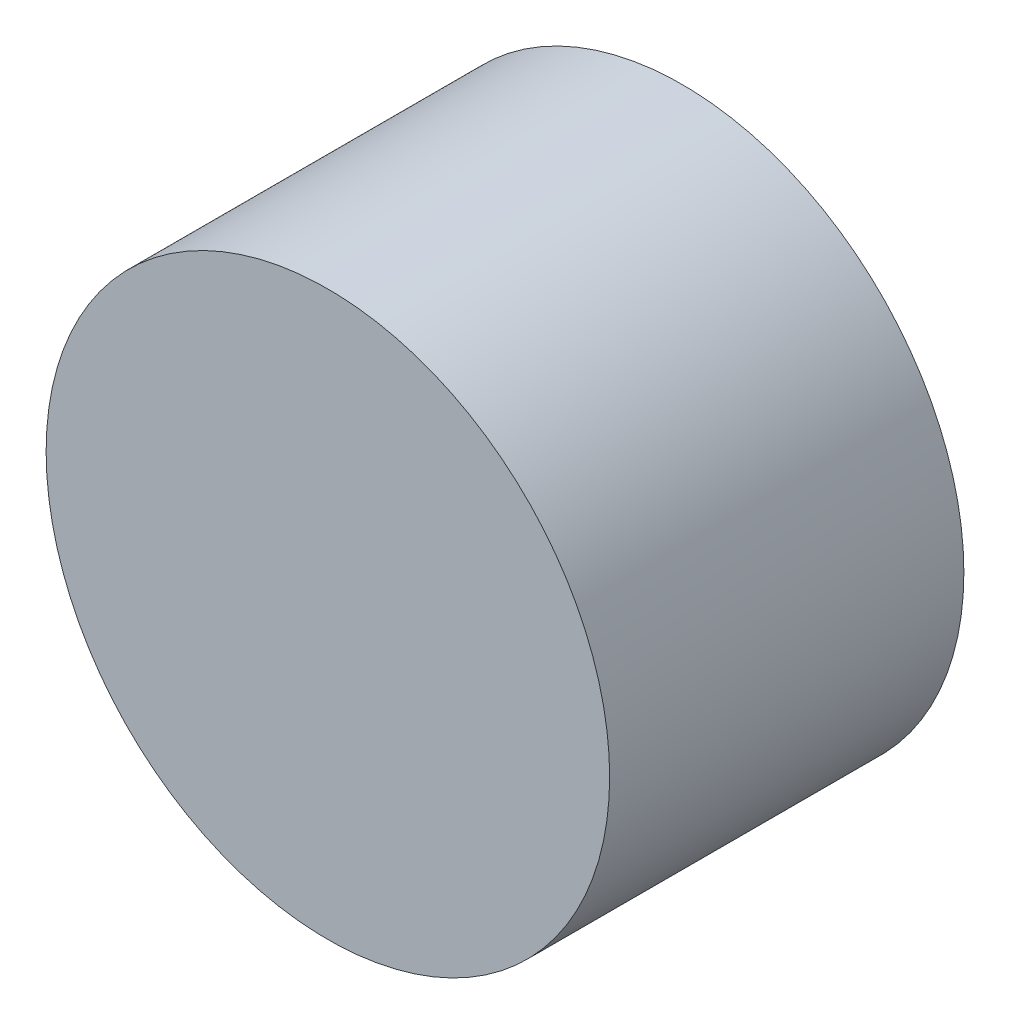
SolidWorks part; units mm, degrees
other "Detailelement1"
ref_plane "Ebene vorne" through (0, 0, 0) normal (0, 0, 1) x (1, 0, 0)
ref_plane "Ebene oben" through (0, 0, 0) normal (0, 1, 0) x (1, 0, 0)
ref_plane "Ebene rechts" through (0, 0, 0) normal (1, 0, 0) x (0, 0, -1)
sketch "hilfsskizze_hinterschnitt" plane through (0, 0, 0) normal (0, 1, 0) x (1, 0, 0)
  line L0 (0, 0) -> (0, 67.7219) construction
  line L1 (-20, 20) -> (-20, -8.1134) construction
  line L2 (-35.1539, 0) -> (-5.6255, 0) construction
  line L3 (-20, 20) -> (-20.5, 0)
  line L4 (-20, 20) -> (-20, 23)
  line L5 (-20, 23) -> (-35, 23)
  line L6 (-35, 23) -> (-35, -13)
  line L7 (-20.5, 0) -> (-19.3923, -5)
  line L8 (-19.3923, -5) -> (-19.3923, -13)
  line L9 (-19.3923, -13) -> (-35, -13)
  line L10 (-12.2305, 2.681) -> (-12.2305, 34.7166) construction
  line L11 (-16.2305, 17.6092) -> (-16.2305, 36.4813)
  line L12 (-8.2305, 17.6092) -> (-8.2305, 36.4813)
  line L13 (-8.2305, 36.4813) -> (-16.2305, 36.4813)
  line L14 (-49.0118, 2.681) -> (11.0731, 2.681) construction
  arc A0 (-16.2305, 17.6092) -> (-8.2305, 17.6092) centre (-12.2305, 10.681) ccw
  point P22 (-20.433, 2.681)
  dimension "D9" = 8
  dimension "D1" = 20
  dimension "D2" = 20
  dimension "D3" = 1
  dimension "D4" = 5
  dimension "D5" = 0.6077
  dimension "D6" = 15
  dimension "D7" = 8
  dimension "D8" = 3
  dimension "D10" = 8
  dimension "D11" = 8.2025
sketch "Skizze2" plane through (0, 0, 0) normal (0, 1, 0) x (1, 0, 0)
  line L0 (-20, 20) -> (-20, 23) construction
  line L1 (-20, 20) -> (-20.5, 0) construction
  line L2 (-20.5, 0) -> (-19.3923, -5) construction
  line L3 (-19.3923, -5) -> (-19.3923, -13) construction
  line L4 (-19.3923, -13) -> (-35, -13) construction
  line L5 (-35, 23) -> (-35, -13) construction
  line L6 (-20, 23) -> (-35, 23) construction
  line L7 (-20, 20) -> (-20, 23)
  line L8 (-20, 20) -> (-20.5, 0)
  line L9 (-20.5, 0) -> (-19.3923, -5)
  line L10 (-19.3923, -5) -> (-19.3923, -13)
  line L11 (-19.3923, -13) -> (-35, -13)
  line L12 (-35, 23) -> (-35, -13)
  line L13 (-20, 23) -> (-35, 23)
revolve "Rotation1" add sketch "Skizze2" angle 360 about L0
sketch "Skizze3" plane through (0, 0, 13) normal (0, 0, 1) x (1, 0, 0)
  circle A0 centre (0, 0) radius 35 construction
  circle A1 centre (0, 0) radius 35
extrude "Linear austragen1" add sketch "Skizze3" along normal blind 8
sketch "Skizze zum verschieben der z schnitte" plane through (0, 0, 0) normal (0, 1, 0) x (1, 0, 0)
  line L1 (-20, 20) -> (-20.5, 0)
  line L2 (20.5, 0) -> (20, 20)
  line L3 (-16.2475, 16.9282) -> (-16.2475, 36.9282)
  line L4 (-8.2475, 36.9282) -> (-16.2475, 36.9282)
  line L5 (-8.2475, 16.9282) -> (-8.2475, 36.9282)
  line L6 (20.5, 0) -> (20, 20)
  line L7 (-12.2475, 2) -> (-12.2475, 62) construction
  line L8 (-20, 20) -> (-20.5, 0) construction
  line L9 (-54.1694, 2) -> (5.9155, 2) construction
  line L11 (19.3923, -5) -> (20.5, 0)
  line L12 (-20.5, 0) -> (-19.3923, -5)
  line L13 (-20, 20) -> (-20, -20.9932) construction
  line L15 (-20.5, 0) -> (-19.3923, -5) construction
  line L16 (19.3923, -5) -> (20.5, 0)
  arc A1 (-16.2475, 16.9282) -> (-8.2475, 16.9282) centre (-12.2475, 10) ccw
  point P11 (-20.35, 6)
  point P12 (-20, -2.2569)
  point P15 (-19.5312, -2.6685)
  dimension "D2" = 8
  dimension "D1" = 8
  dimension "D3" = 20
  dimension "D4" = 60
  dimension "D5" = 9.0361
  dimension "D6" = 10
ref_plane "schnittebene" through (0, 0, -2) normal (0, 0, -1) x (-1, 0, 0)
sketch "bahn zum fräsen" plane through (0, 0, -2) normal (0, 0, -1) x (-1, 0, 0)
  circle A0 centre (0, 0) radius 20.45
  circle A1 centre (0, 0) radius 20.45 construction
  circle A4 centre (0, 0) radius 12.3
  circle A5 centre (0, 0) radius 12.3
  dimension "D1" = 8.2
